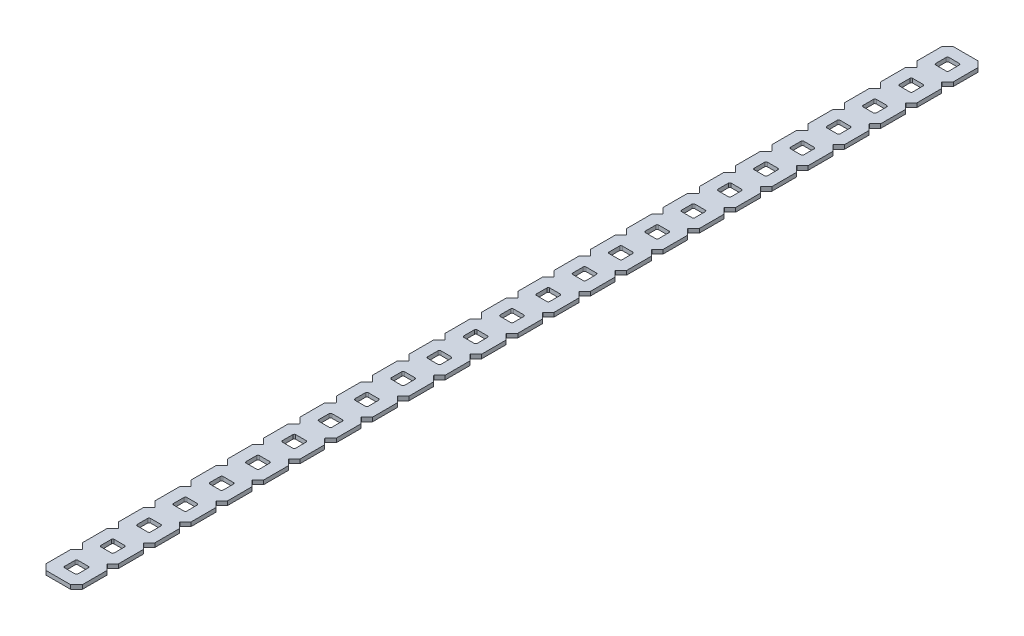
SolidWorks part; units mm, degrees
ref_plane "Front Plane" through (0, 0, 0) normal (0, 0, 1) x (1, 0, 0)
ref_plane "Top Plane" through (0, 0, 0) normal (0, 1, 0) x (1, 0, 0)
ref_plane "Right Plane" through (0, 0, 0) normal (1, 0, 0) x (0, 0, -1)
ref_plane "Plane1" through (0, 0, 0) normal (0, -1, 0) x (1, 0, 0)
sketch "Sketch1" plane through (0, 0, 0) normal (0, -1, 0) x (1, 0, 0)
  line L0 (4.5466, -308.8386) -> (8.1534, -308.8386)
  line L1 (8.6614, -309.3466) -> (8.6614, -312.9534)
  line L2 (8.1534, -313.4614) -> (4.5466, -313.4614)
  line L3 (4.0386, -312.9534) -> (4.0386, -309.3466)
  line L4 (4.5466, -296.1386) -> (8.1534, -296.1386)
  line L5 (8.6614, -296.6466) -> (8.6614, -300.2534)
  line L6 (8.1534, -300.7614) -> (4.5466, -300.7614)
  line L7 (4.0386, -300.2534) -> (4.0386, -296.6466)
  line L8 (4.5466, -283.4386) -> (8.1534, -283.4386)
  line L9 (8.6614, -283.9466) -> (8.6614, -287.5534)
  line L10 (8.1534, -288.0614) -> (4.5466, -288.0614)
  line L11 (4.0386, -287.5534) -> (4.0386, -283.9466)
  line L12 (4.5466, -270.7386) -> (8.1534, -270.7386)
  line L13 (8.6614, -271.2466) -> (8.6614, -274.8534)
  line L14 (8.1534, -275.3614) -> (4.5466, -275.3614)
  line L15 (4.0386, -274.8534) -> (4.0386, -271.2466)
  line L16 (4.5466, -258.0386) -> (8.1534, -258.0386)
  line L17 (8.6614, -258.5466) -> (8.6614, -262.1534)
  line L18 (8.1534, -262.6614) -> (4.5466, -262.6614)
  line L19 (4.0386, -262.1534) -> (4.0386, -258.5466)
  line L20 (4.5466, -245.3386) -> (8.1534, -245.3386)
  line L21 (8.6614, -245.8466) -> (8.6614, -249.4534)
  line L22 (8.1534, -249.9614) -> (4.5466, -249.9614)
  line L23 (4.0386, -249.4534) -> (4.0386, -245.8466)
  line L24 (4.5466, -232.6386) -> (8.1534, -232.6386)
  line L25 (8.6614, -233.1466) -> (8.6614, -236.7534)
  line L26 (8.1534, -237.2614) -> (4.5466, -237.2614)
  line L27 (4.0386, -236.7534) -> (4.0386, -233.1466)
  line L28 (4.5466, -219.9386) -> (8.1534, -219.9386)
  line L29 (8.6614, -220.4466) -> (8.6614, -224.0534)
  line L30 (8.1534, -224.5614) -> (4.5466, -224.5614)
  line L31 (4.0386, -224.0534) -> (4.0386, -220.4466)
  line L32 (4.5466, -207.2386) -> (8.1534, -207.2386)
  line L33 (8.6614, -207.7466) -> (8.6614, -211.3534)
  line L34 (8.1534, -211.8614) -> (4.5466, -211.8614)
  line L35 (4.0386, -211.3534) -> (4.0386, -207.7466)
  line L36 (4.5466, -194.5386) -> (8.1534, -194.5386)
  line L37 (8.6614, -195.0466) -> (8.6614, -198.6534)
  line L38 (8.1534, -199.1614) -> (4.5466, -199.1614)
  line L39 (4.0386, -198.6534) -> (4.0386, -195.0466)
  line L40 (4.5466, -181.8386) -> (8.1534, -181.8386)
  line L41 (8.6614, -182.3466) -> (8.6614, -185.9534)
  line L42 (8.1534, -186.4614) -> (4.5466, -186.4614)
  line L43 (4.0386, -185.9534) -> (4.0386, -182.3466)
  line L44 (4.5466, -169.1386) -> (8.1534, -169.1386)
  line L45 (8.6614, -169.6466) -> (8.6614, -173.2534)
  line L46 (8.1534, -173.7614) -> (4.5466, -173.7614)
  line L47 (4.0386, -173.2534) -> (4.0386, -169.6466)
  line L48 (4.5466, -156.4386) -> (8.1534, -156.4386)
  line L49 (8.6614, -156.9466) -> (8.6614, -160.5534)
  line L50 (8.1534, -161.0614) -> (4.5466, -161.0614)
  line L51 (4.0386, -160.5534) -> (4.0386, -156.9466)
  line L52 (4.5466, -143.7386) -> (8.1534, -143.7386)
  line L53 (8.6614, -144.2466) -> (8.6614, -147.8534)
  line L54 (8.1534, -148.3614) -> (4.5466, -148.3614)
  line L55 (4.0386, -147.8534) -> (4.0386, -144.2466)
  line L56 (4.5466, -131.0386) -> (8.1534, -131.0386)
  line L57 (8.6614, -131.5466) -> (8.6614, -135.1534)
  line L58 (8.1534, -135.6614) -> (4.5466, -135.6614)
  line L59 (4.0386, -135.1534) -> (4.0386, -131.5466)
  line L60 (4.5466, -118.3386) -> (8.1534, -118.3386)
  line L61 (8.6614, -118.8466) -> (8.6614, -122.4534)
  line L62 (8.1534, -122.9614) -> (4.5466, -122.9614)
  line L63 (4.0386, -122.4534) -> (4.0386, -118.8466)
  line L64 (4.5466, -105.6386) -> (8.1534, -105.6386)
  line L65 (8.6614, -106.1466) -> (8.6614, -109.7534)
  line L66 (8.1534, -110.2614) -> (4.5466, -110.2614)
  line L67 (4.0386, -109.7534) -> (4.0386, -106.1466)
  line L68 (4.5466, -92.9386) -> (8.1534, -92.9386)
  line L69 (8.6614, -93.4466) -> (8.6614, -97.0534)
  line L70 (8.1534, -97.5614) -> (4.5466, -97.5614)
  line L71 (4.0386, -97.0534) -> (4.0386, -93.4466)
  line L72 (4.5466, -80.2386) -> (8.1534, -80.2386)
  line L73 (8.6614, -80.7466) -> (8.6614, -84.3534)
  line L74 (8.1534, -84.8614) -> (4.5466, -84.8614)
  line L75 (4.0386, -84.3534) -> (4.0386, -80.7466)
  line L76 (4.5466, -67.5386) -> (8.1534, -67.5386)
  line L77 (8.6614, -68.0466) -> (8.6614, -71.6534)
  line L78 (8.1534, -72.1614) -> (4.5466, -72.1614)
  line L79 (4.0386, -71.6534) -> (4.0386, -68.0466)
  line L80 (4.5466, -54.8386) -> (8.1534, -54.8386)
  line L81 (8.6614, -55.3466) -> (8.6614, -58.9534)
  line L82 (8.1534, -59.4614) -> (4.5466, -59.4614)
  line L83 (4.0386, -58.9534) -> (4.0386, -55.3466)
  line L84 (4.5466, -42.1386) -> (8.1534, -42.1386)
  line L85 (8.6614, -42.6466) -> (8.6614, -46.2534)
  line L86 (8.1534, -46.7614) -> (4.5466, -46.7614)
  line L87 (4.0386, -46.2534) -> (4.0386, -42.6466)
  line L88 (4.5466, -29.4386) -> (8.1534, -29.4386)
  line L89 (8.6614, -29.9466) -> (8.6614, -33.5534)
  line L90 (8.1534, -34.0614) -> (4.5466, -34.0614)
  line L91 (4.0386, -33.5534) -> (4.0386, -29.9466)
  line L92 (12.7, -302.773) -> (12.7, -294.127)
  line L93 (12.7, -294.127) -> (10.7628, -292.1898)
  line L94 (10.7628, -292.0102) -> (12.7, -290.073)
  line L95 (12.7, -290.073) -> (12.7, -281.427)
  line L96 (12.7, -281.427) -> (10.7628, -279.4898)
  line L97 (10.7628, -279.3102) -> (12.7, -277.373)
  line L98 (12.7, -277.373) -> (12.7, -268.727)
  line L99 (12.7, -268.727) -> (10.7628, -266.7898)
  line L100 (10.7628, -266.6102) -> (12.7, -264.673)
  line L101 (12.7, -264.673) -> (12.7, -256.027)
  line L102 (12.7, -256.027) -> (10.7628, -254.0898)
  line L103 (10.7628, -253.9102) -> (12.7, -251.973)
  line L104 (12.7, -251.973) -> (12.7, -243.327)
  line L105 (12.7, -243.327) -> (10.7628, -241.3898)
  line L106 (10.7628, -241.2102) -> (12.7, -239.273)
  line L107 (12.7, -239.273) -> (12.7, -230.627)
  line L108 (12.7, -230.627) -> (10.7628, -228.6898)
  line L109 (10.7628, -228.5102) -> (12.7, -226.573)
  line L110 (12.7, -226.573) -> (12.7, -217.927)
  line L111 (12.7, -217.927) -> (10.7628, -215.9898)
  line L112 (10.7628, -215.8102) -> (12.7, -213.873)
  line L113 (12.7, -213.873) -> (12.7, -205.227)
  line L114 (12.7, -205.227) -> (10.7628, -203.2898)
  line L115 (10.7628, -203.1102) -> (12.7, -201.173)
  line L116 (12.7, -201.173) -> (12.7, -192.527)
  line L117 (12.7, -192.527) -> (10.7628, -190.5898)
  line L118 (10.7628, -190.4102) -> (12.7, -188.473)
  line L119 (12.7, -188.473) -> (12.7, -179.827)
  line L120 (12.7, -179.827) -> (10.7628, -177.8898)
  line L121 (10.7628, -177.7102) -> (12.7, -175.773)
  line L122 (12.7, -175.773) -> (12.7, -167.127)
  line L123 (12.7, -167.127) -> (10.7628, -165.1898)
  line L124 (10.7628, -165.0102) -> (12.7, -163.073)
  line L125 (12.7, -163.073) -> (12.7, -154.427)
  line L126 (12.7, -154.427) -> (10.7628, -152.4898)
  line L127 (10.7628, -152.3102) -> (12.7, -150.373)
  line L128 (12.7, -150.373) -> (12.7, -141.727)
  line L129 (12.7, -141.727) -> (10.7628, -139.7898)
  line L130 (10.7628, -139.6102) -> (12.7, -137.673)
  line L131 (12.7, -137.673) -> (12.7, -129.027)
  line L132 (12.7, -129.027) -> (10.7628, -127.0898)
  line L133 (10.7628, -126.9102) -> (12.7, -124.973)
  line L134 (12.7, -124.973) -> (12.7, -116.327)
  line L135 (12.7, -116.327) -> (10.7628, -114.3898)
  line L136 (10.7628, -114.2102) -> (12.7, -112.273)
  line L137 (12.7, -112.273) -> (12.7, -103.627)
  line L138 (12.7, -103.627) -> (10.7628, -101.6898)
  line L139 (10.7628, -101.5102) -> (12.7, -99.573)
  line L140 (12.7, -99.573) -> (12.7, -90.927)
  line L141 (12.7, -90.927) -> (10.7628, -88.9898)
  line L142 (10.7628, -88.8102) -> (12.7, -86.873)
  line L143 (12.7, -86.873) -> (12.7, -78.227)
  line L144 (12.7, -78.227) -> (10.7628, -76.2898)
  line L145 (10.7628, -76.1102) -> (12.7, -74.173)
  line L146 (12.7, -74.173) -> (12.7, -65.527)
  line L147 (12.7, -65.527) -> (10.7628, -63.5898)
  line L148 (10.7628, -63.4102) -> (12.7, -61.473)
  line L149 (12.7, -61.473) -> (12.7, -52.827)
  line L150 (12.7, -52.827) -> (10.7628, -50.8898)
  line L151 (10.7628, -50.7102) -> (12.7, -48.773)
  line L152 (12.7, -48.773) -> (12.7, -40.127)
  line L153 (12.7, -40.127) -> (10.7628, -38.1898)
  line L154 (10.7628, -38.0102) -> (12.7, -36.073)
  line L155 (12.7, -36.073) -> (12.7, -27.427)
  line L156 (12.7, -27.427) -> (10.7628, -25.4898)
  line L157 (10.7628, -25.3102) -> (12.7, -23.373)
  line L158 (12.7, -23.373) -> (12.7, -14.727)
  line L159 (12.7, -14.727) -> (10.7628, -12.7898)
  line L160 (10.7628, -12.6102) -> (12.7, -10.673)
  line L161 (12.7, -10.673) -> (12.7, -2.032)
  line L162 (12.7, -2.032) -> (10.668, 0)
  line L163 (10.668, 0) -> (2.032, 0)
  line L164 (2.032, 0) -> (0, -2.032)
  line L165 (0, -2.032) -> (0, -10.673)
  line L166 (0, -10.673) -> (1.9372, -12.6102)
  line L167 (1.9372, -12.7898) -> (0, -14.727)
  line L168 (0, -14.727) -> (0, -23.373)
  line L169 (0, -23.373) -> (1.9372, -25.3102)
  line L170 (1.9372, -25.4898) -> (0, -27.427)
  line L171 (0, -27.427) -> (0, -36.073)
  line L172 (0, -36.073) -> (1.9372, -38.0102)
  line L173 (1.9372, -38.1898) -> (0, -40.127)
  line L174 (0, -40.127) -> (0, -48.773)
  line L175 (0, -48.773) -> (1.9372, -50.7102)
  line L176 (1.9372, -50.8898) -> (0, -52.827)
  line L177 (0, -52.827) -> (0, -61.473)
  line L178 (0, -61.473) -> (1.9372, -63.4102)
  line L179 (1.9372, -63.5898) -> (0, -65.527)
  line L180 (0, -65.527) -> (0, -74.173)
  line L181 (0, -74.173) -> (1.9372, -76.1102)
  line L182 (1.9372, -76.2898) -> (0, -78.227)
  line L183 (0, -78.227) -> (0, -86.873)
  line L184 (0, -86.873) -> (1.9372, -88.8102)
  line L185 (1.9372, -88.9898) -> (0, -90.927)
  line L186 (0, -90.927) -> (0, -99.573)
  line L187 (0, -99.573) -> (1.9372, -101.5102)
  line L188 (1.9372, -101.6898) -> (0, -103.627)
  line L189 (0, -103.627) -> (0, -112.273)
  line L190 (0, -112.273) -> (1.9372, -114.2102)
  line L191 (1.9372, -114.3898) -> (0, -116.327)
  line L192 (0, -116.327) -> (0, -124.973)
  line L193 (0, -124.973) -> (1.9372, -126.9102)
  line L194 (1.9372, -127.0898) -> (0, -129.027)
  line L195 (0, -129.027) -> (0, -137.673)
  line L196 (0, -137.673) -> (1.9372, -139.6102)
  line L197 (1.9372, -139.7898) -> (0, -141.727)
  line L198 (0, -141.727) -> (0, -150.373)
  line L199 (0, -150.373) -> (1.9372, -152.3102)
  line L200 (1.9372, -152.4898) -> (0, -154.427)
  line L201 (0, -154.427) -> (0, -163.073)
  line L202 (0, -163.073) -> (1.9372, -165.0102)
  line L203 (1.9372, -165.1898) -> (0, -167.127)
  line L204 (0, -167.127) -> (0, -175.773)
  line L205 (0, -175.773) -> (1.9372, -177.7102)
  line L206 (1.9372, -177.8898) -> (0, -179.827)
  line L207 (0, -179.827) -> (0, -188.473)
  line L208 (0, -188.473) -> (1.9372, -190.4102)
  line L209 (1.9372, -190.5898) -> (0, -192.527)
  line L210 (0, -192.527) -> (0, -201.173)
  line L211 (0, -201.173) -> (1.9372, -203.1102)
  line L212 (1.9372, -203.2898) -> (0, -205.227)
  line L213 (0, -205.227) -> (0, -213.873)
  line L214 (0, -213.873) -> (1.9372, -215.8102)
  line L215 (1.9372, -215.9898) -> (0, -217.927)
  line L216 (0, -217.927) -> (0, -226.573)
  line L217 (0, -226.573) -> (1.9372, -228.5102)
  line L218 (1.9372, -228.6898) -> (0, -230.627)
  line L219 (0, -230.627) -> (0, -239.273)
  line L220 (0, -239.273) -> (1.9372, -241.2102)
  line L221 (1.9372, -241.3898) -> (0, -243.327)
  line L222 (0, -243.327) -> (0, -251.973)
  line L223 (0, -251.973) -> (1.9372, -253.9102)
  line L224 (1.9372, -254.0898) -> (0, -256.027)
  line L225 (0, -256.027) -> (0, -264.673)
  line L226 (0, -264.673) -> (1.9372, -266.6102)
  line L227 (1.9372, -266.7898) -> (0, -268.727)
  line L228 (0, -268.727) -> (0, -277.373)
  line L229 (0, -277.373) -> (1.9372, -279.3102)
  line L230 (1.9372, -279.4898) -> (0, -281.427)
  line L231 (0, -281.427) -> (0, -290.073)
  line L232 (0, -290.073) -> (1.9372, -292.0102)
  line L233 (1.9372, -292.1898) -> (0, -294.127)
  line L234 (0, -294.127) -> (0, -302.773)
  line L235 (0, -302.773) -> (1.9372, -304.7102)
  line L236 (1.9372, -304.8898) -> (0, -306.827)
  line L237 (0, -306.827) -> (0, -315.468)
  line L238 (0, -315.468) -> (2.032, -317.5)
  line L239 (2.032, -317.5) -> (10.668, -317.5)
  line L240 (10.668, -317.5) -> (12.7, -315.468)
  line L241 (12.7, -315.468) -> (12.7, -306.827)
  line L242 (12.7, -306.827) -> (10.7628, -304.8898)
  line L243 (10.7628, -304.7102) -> (12.7, -302.773)
  line L244 (8.1534, -8.6614) -> (4.5466, -8.6614)
  line L245 (4.0386, -8.1534) -> (4.0386, -4.5466)
  line L246 (4.5466, -4.0386) -> (8.1534, -4.0386)
  line L247 (8.6614, -4.5466) -> (8.6614, -8.1534)
  line L248 (4.0386, -20.8534) -> (4.0386, -17.2466)
  line L249 (4.5466, -16.7386) -> (8.1534, -16.7386)
  line L250 (8.6614, -17.2466) -> (8.6614, -20.8534)
  line L251 (8.1534, -21.3614) -> (4.5466, -21.3614)
  arc A0 (4.0386, -309.3466) -> (4.5466, -308.8386) centre (4.5466, -309.3466) cw
  arc A1 (8.1534, -308.8386) -> (8.6614, -309.3466) centre (8.1534, -309.3466) cw
  arc A2 (8.6614, -312.9534) -> (8.1534, -313.4614) centre (8.1534, -312.9534) cw
  arc A3 (4.5466, -313.4614) -> (4.0386, -312.9534) centre (4.5466, -312.9534) cw
  arc A4 (4.0386, -296.6466) -> (4.5466, -296.1386) centre (4.5466, -296.6466) cw
  arc A5 (8.1534, -296.1386) -> (8.6614, -296.6466) centre (8.1534, -296.6466) cw
  arc A6 (8.6614, -300.2534) -> (8.1534, -300.7614) centre (8.1534, -300.2534) cw
  arc A7 (4.5466, -300.7614) -> (4.0386, -300.2534) centre (4.5466, -300.2534) cw
  arc A8 (4.0386, -283.9466) -> (4.5466, -283.4386) centre (4.5466, -283.9466) cw
  arc A9 (8.1534, -283.4386) -> (8.6614, -283.9466) centre (8.1534, -283.9466) cw
  arc A10 (8.6614, -287.5534) -> (8.1534, -288.0614) centre (8.1534, -287.5534) cw
  arc A11 (4.5466, -288.0614) -> (4.0386, -287.5534) centre (4.5466, -287.5534) cw
  arc A12 (4.0386, -271.2466) -> (4.5466, -270.7386) centre (4.5466, -271.2466) cw
  arc A13 (8.1534, -270.7386) -> (8.6614, -271.2466) centre (8.1534, -271.2466) cw
  arc A14 (8.6614, -274.8534) -> (8.1534, -275.3614) centre (8.1534, -274.8534) cw
  arc A15 (4.5466, -275.3614) -> (4.0386, -274.8534) centre (4.5466, -274.8534) cw
  arc A16 (4.0386, -258.5466) -> (4.5466, -258.0386) centre (4.5466, -258.5466) cw
  arc A17 (8.1534, -258.0386) -> (8.6614, -258.5466) centre (8.1534, -258.5466) cw
  arc A18 (8.6614, -262.1534) -> (8.1534, -262.6614) centre (8.1534, -262.1534) cw
  arc A19 (4.5466, -262.6614) -> (4.0386, -262.1534) centre (4.5466, -262.1534) cw
  arc A20 (4.0386, -245.8466) -> (4.5466, -245.3386) centre (4.5466, -245.8466) cw
  arc A21 (8.1534, -245.3386) -> (8.6614, -245.8466) centre (8.1534, -245.8466) cw
  arc A22 (8.6614, -249.4534) -> (8.1534, -249.9614) centre (8.1534, -249.4534) cw
  arc A23 (4.5466, -249.9614) -> (4.0386, -249.4534) centre (4.5466, -249.4534) cw
  arc A24 (4.0386, -233.1466) -> (4.5466, -232.6386) centre (4.5466, -233.1466) cw
  arc A25 (8.1534, -232.6386) -> (8.6614, -233.1466) centre (8.1534, -233.1466) cw
  arc A26 (8.6614, -236.7534) -> (8.1534, -237.2614) centre (8.1534, -236.7534) cw
  arc A27 (4.5466, -237.2614) -> (4.0386, -236.7534) centre (4.5466, -236.7534) cw
  arc A28 (4.0386, -220.4466) -> (4.5466, -219.9386) centre (4.5466, -220.4466) cw
  arc A29 (8.1534, -219.9386) -> (8.6614, -220.4466) centre (8.1534, -220.4466) cw
  arc A30 (8.6614, -224.0534) -> (8.1534, -224.5614) centre (8.1534, -224.0534) cw
  arc A31 (4.5466, -224.5614) -> (4.0386, -224.0534) centre (4.5466, -224.0534) cw
  arc A32 (4.0386, -207.7466) -> (4.5466, -207.2386) centre (4.5466, -207.7466) cw
  arc A33 (8.1534, -207.2386) -> (8.6614, -207.7466) centre (8.1534, -207.7466) cw
  arc A34 (8.6614, -211.3534) -> (8.1534, -211.8614) centre (8.1534, -211.3534) cw
  arc A35 (4.5466, -211.8614) -> (4.0386, -211.3534) centre (4.5466, -211.3534) cw
  arc A36 (4.0386, -195.0466) -> (4.5466, -194.5386) centre (4.5466, -195.0466) cw
  arc A37 (8.1534, -194.5386) -> (8.6614, -195.0466) centre (8.1534, -195.0466) cw
  arc A38 (8.6614, -198.6534) -> (8.1534, -199.1614) centre (8.1534, -198.6534) cw
  arc A39 (4.5466, -199.1614) -> (4.0386, -198.6534) centre (4.5466, -198.6534) cw
  arc A40 (4.0386, -182.3466) -> (4.5466, -181.8386) centre (4.5466, -182.3466) cw
  arc A41 (8.1534, -181.8386) -> (8.6614, -182.3466) centre (8.1534, -182.3466) cw
  arc A42 (8.6614, -185.9534) -> (8.1534, -186.4614) centre (8.1534, -185.9534) cw
  arc A43 (4.5466, -186.4614) -> (4.0386, -185.9534) centre (4.5466, -185.9534) cw
  arc A44 (4.0386, -169.6466) -> (4.5466, -169.1386) centre (4.5466, -169.6466) cw
  arc A45 (8.1534, -169.1386) -> (8.6614, -169.6466) centre (8.1534, -169.6466) cw
  arc A46 (8.6614, -173.2534) -> (8.1534, -173.7614) centre (8.1534, -173.2534) cw
  arc A47 (4.5466, -173.7614) -> (4.0386, -173.2534) centre (4.5466, -173.2534) cw
  arc A48 (4.0386, -156.9466) -> (4.5466, -156.4386) centre (4.5466, -156.9466) cw
  arc A49 (8.1534, -156.4386) -> (8.6614, -156.9466) centre (8.1534, -156.9466) cw
  arc A50 (8.6614, -160.5534) -> (8.1534, -161.0614) centre (8.1534, -160.5534) cw
  arc A51 (4.5466, -161.0614) -> (4.0386, -160.5534) centre (4.5466, -160.5534) cw
  arc A52 (4.0386, -144.2466) -> (4.5466, -143.7386) centre (4.5466, -144.2466) cw
  arc A53 (8.1534, -143.7386) -> (8.6614, -144.2466) centre (8.1534, -144.2466) cw
  arc A54 (8.6614, -147.8534) -> (8.1534, -148.3614) centre (8.1534, -147.8534) cw
  arc A55 (4.5466, -148.3614) -> (4.0386, -147.8534) centre (4.5466, -147.8534) cw
  arc A56 (4.0386, -131.5466) -> (4.5466, -131.0386) centre (4.5466, -131.5466) cw
  arc A57 (8.1534, -131.0386) -> (8.6614, -131.5466) centre (8.1534, -131.5466) cw
  arc A58 (8.6614, -135.1534) -> (8.1534, -135.6614) centre (8.1534, -135.1534) cw
  arc A59 (4.5466, -135.6614) -> (4.0386, -135.1534) centre (4.5466, -135.1534) cw
  arc A60 (4.0386, -118.8466) -> (4.5466, -118.3386) centre (4.5466, -118.8466) cw
  arc A61 (8.1534, -118.3386) -> (8.6614, -118.8466) centre (8.1534, -118.8466) cw
  arc A62 (8.6614, -122.4534) -> (8.1534, -122.9614) centre (8.1534, -122.4534) cw
  arc A63 (4.5466, -122.9614) -> (4.0386, -122.4534) centre (4.5466, -122.4534) cw
  arc A64 (4.0386, -106.1466) -> (4.5466, -105.6386) centre (4.5466, -106.1466) cw
  arc A65 (8.1534, -105.6386) -> (8.6614, -106.1466) centre (8.1534, -106.1466) cw
  arc A66 (8.6614, -109.7534) -> (8.1534, -110.2614) centre (8.1534, -109.7534) cw
  arc A67 (4.5466, -110.2614) -> (4.0386, -109.7534) centre (4.5466, -109.7534) cw
  arc A68 (4.0386, -93.4466) -> (4.5466, -92.9386) centre (4.5466, -93.4466) cw
  arc A69 (8.1534, -92.9386) -> (8.6614, -93.4466) centre (8.1534, -93.4466) cw
  arc A70 (8.6614, -97.0534) -> (8.1534, -97.5614) centre (8.1534, -97.0534) cw
  arc A71 (4.5466, -97.5614) -> (4.0386, -97.0534) centre (4.5466, -97.0534) cw
  arc A72 (4.0386, -80.7466) -> (4.5466, -80.2386) centre (4.5466, -80.7466) cw
  arc A73 (8.1534, -80.2386) -> (8.6614, -80.7466) centre (8.1534, -80.7466) cw
  arc A74 (8.6614, -84.3534) -> (8.1534, -84.8614) centre (8.1534, -84.3534) cw
  arc A75 (4.5466, -84.8614) -> (4.0386, -84.3534) centre (4.5466, -84.3534) cw
  arc A76 (4.0386, -68.0466) -> (4.5466, -67.5386) centre (4.5466, -68.0466) cw
  arc A77 (8.1534, -67.5386) -> (8.6614, -68.0466) centre (8.1534, -68.0466) cw
  arc A78 (8.6614, -71.6534) -> (8.1534, -72.1614) centre (8.1534, -71.6534) cw
  arc A79 (4.5466, -72.1614) -> (4.0386, -71.6534) centre (4.5466, -71.6534) cw
  arc A80 (4.0386, -55.3466) -> (4.5466, -54.8386) centre (4.5466, -55.3466) cw
  arc A81 (8.1534, -54.8386) -> (8.6614, -55.3466) centre (8.1534, -55.3466) cw
  arc A82 (8.6614, -58.9534) -> (8.1534, -59.4614) centre (8.1534, -58.9534) cw
  arc A83 (4.5466, -59.4614) -> (4.0386, -58.9534) centre (4.5466, -58.9534) cw
  arc A84 (4.0386, -42.6466) -> (4.5466, -42.1386) centre (4.5466, -42.6466) cw
  arc A85 (8.1534, -42.1386) -> (8.6614, -42.6466) centre (8.1534, -42.6466) cw
  arc A86 (8.6614, -46.2534) -> (8.1534, -46.7614) centre (8.1534, -46.2534) cw
  arc A87 (4.5466, -46.7614) -> (4.0386, -46.2534) centre (4.5466, -46.2534) cw
  arc A88 (4.0386, -29.9466) -> (4.5466, -29.4386) centre (4.5466, -29.9466) cw
  arc A89 (8.1534, -29.4386) -> (8.6614, -29.9466) centre (8.1534, -29.9466) cw
  arc A90 (8.6614, -33.5534) -> (8.1534, -34.0614) centre (8.1534, -33.5534) cw
  arc A91 (4.5466, -34.0614) -> (4.0386, -33.5534) centre (4.5466, -33.5534) cw
  arc A92 (10.7628, -292.1898) -> (10.7628, -292.0102) centre (10.8526, -292.1) cw
  arc A93 (10.7628, -279.4898) -> (10.7628, -279.3102) centre (10.8526, -279.4) cw
  arc A94 (10.7628, -266.7898) -> (10.7628, -266.6102) centre (10.8526, -266.7) cw
  arc A95 (10.7628, -254.0898) -> (10.7628, -253.9102) centre (10.8526, -254) cw
  arc A96 (10.7628, -241.3898) -> (10.7628, -241.2102) centre (10.8526, -241.3) cw
  arc A97 (10.7628, -228.6898) -> (10.7628, -228.5102) centre (10.8526, -228.6) cw
  arc A98 (10.7628, -215.9898) -> (10.7628, -215.8102) centre (10.8526, -215.9) cw
  arc A99 (10.7628, -203.2898) -> (10.7628, -203.1102) centre (10.8526, -203.2) cw
  arc A100 (10.7628, -190.5898) -> (10.7628, -190.4102) centre (10.8526, -190.5) cw
  arc A101 (10.7628, -177.8898) -> (10.7628, -177.7102) centre (10.8526, -177.8) cw
  arc A102 (10.7628, -165.1898) -> (10.7628, -165.0102) centre (10.8526, -165.1) cw
  arc A103 (10.7628, -152.4898) -> (10.7628, -152.3102) centre (10.8526, -152.4) cw
  arc A104 (10.7628, -139.7898) -> (10.7628, -139.6102) centre (10.8526, -139.7) cw
  arc A105 (10.7628, -127.0898) -> (10.7628, -126.9102) centre (10.8526, -127) cw
  arc A106 (10.7628, -114.3898) -> (10.7628, -114.2102) centre (10.8526, -114.3) cw
  arc A107 (10.7628, -101.6898) -> (10.7628, -101.5102) centre (10.8526, -101.6) cw
  arc A108 (10.7628, -88.9898) -> (10.7628, -88.8102) centre (10.8526, -88.9) cw
  arc A109 (10.7628, -76.2898) -> (10.7628, -76.1102) centre (10.8526, -76.2) cw
  arc A110 (10.7628, -63.5898) -> (10.7628, -63.4102) centre (10.8526, -63.5) cw
  arc A111 (10.7628, -50.8898) -> (10.7628, -50.7102) centre (10.8526, -50.8) cw
  arc A112 (10.7628, -38.1898) -> (10.7628, -38.0102) centre (10.8526, -38.1) cw
  arc A113 (10.7628, -25.4898) -> (10.7628, -25.3102) centre (10.8526, -25.4) cw
  arc A114 (10.7628, -12.7898) -> (10.7628, -12.6102) centre (10.8526, -12.7) cw
  arc A115 (1.9372, -12.6102) -> (1.9372, -12.7898) centre (1.8474, -12.7) cw
  arc A116 (1.9372, -25.3102) -> (1.9372, -25.4898) centre (1.8474, -25.4) cw
  arc A117 (1.9372, -38.0102) -> (1.9372, -38.1898) centre (1.8474, -38.1) cw
  arc A118 (1.9372, -50.7102) -> (1.9372, -50.8898) centre (1.8474, -50.8) cw
  arc A119 (1.9372, -63.4102) -> (1.9372, -63.5898) centre (1.8474, -63.5) cw
  arc A120 (1.9372, -76.1102) -> (1.9372, -76.2898) centre (1.8474, -76.2) cw
  arc A121 (1.9372, -88.8102) -> (1.9372, -88.9898) centre (1.8474, -88.9) cw
  arc A122 (1.9372, -101.5102) -> (1.9372, -101.6898) centre (1.8474, -101.6) cw
  arc A123 (1.9372, -114.2102) -> (1.9372, -114.3898) centre (1.8474, -114.3) cw
  arc A124 (1.9372, -126.9102) -> (1.9372, -127.0898) centre (1.8474, -127) cw
  arc A125 (1.9372, -139.6102) -> (1.9372, -139.7898) centre (1.8474, -139.7) cw
  arc A126 (1.9372, -152.3102) -> (1.9372, -152.4898) centre (1.8474, -152.4) cw
  arc A127 (1.9372, -165.0102) -> (1.9372, -165.1898) centre (1.8474, -165.1) cw
  arc A128 (1.9372, -177.7102) -> (1.9372, -177.8898) centre (1.8474, -177.8) cw
  arc A129 (1.9372, -190.4102) -> (1.9372, -190.5898) centre (1.8474, -190.5) cw
  arc A130 (1.9372, -203.1102) -> (1.9372, -203.2898) centre (1.8474, -203.2) cw
  arc A131 (1.9372, -215.8102) -> (1.9372, -215.9898) centre (1.8474, -215.9) cw
  arc A132 (1.9372, -228.5102) -> (1.9372, -228.6898) centre (1.8474, -228.6) cw
  arc A133 (1.9372, -241.2102) -> (1.9372, -241.3898) centre (1.8474, -241.3) cw
  arc A134 (1.9372, -253.9102) -> (1.9372, -254.0898) centre (1.8474, -254) cw
  arc A135 (1.9372, -266.6102) -> (1.9372, -266.7898) centre (1.8474, -266.7) cw
  arc A136 (1.9372, -279.3102) -> (1.9372, -279.4898) centre (1.8474, -279.4) cw
  arc A137 (1.9372, -292.0102) -> (1.9372, -292.1898) centre (1.8474, -292.1) cw
  arc A138 (1.9372, -304.7102) -> (1.9372, -304.8898) centre (1.8474, -304.8) cw
  arc A139 (10.7628, -304.8898) -> (10.7628, -304.7102) centre (10.8526, -304.8) cw
  arc A140 (8.6614, -8.1534) -> (8.1534, -8.6614) centre (8.1534, -8.1534) cw
  arc A141 (4.5466, -8.6614) -> (4.0386, -8.1534) centre (4.5466, -8.1534) cw
  arc A142 (4.0386, -4.5466) -> (4.5466, -4.0386) centre (4.5466, -4.5466) cw
  arc A143 (8.1534, -4.0386) -> (8.6614, -4.5466) centre (8.1534, -4.5466) cw
  arc A144 (4.0386, -17.2466) -> (4.5466, -16.7386) centre (4.5466, -17.2466) cw
  arc A145 (8.1534, -16.7386) -> (8.6614, -17.2466) centre (8.1534, -17.2466) cw
  arc A146 (8.6614, -20.8534) -> (8.1534, -21.3614) centre (8.1534, -20.8534) cw
  arc A147 (4.5466, -21.3614) -> (4.0386, -20.8534) centre (4.5466, -20.8534) cw
extrude "Boss-Extrude1" add sketch "Sketch1" against normal blind 1.4224
